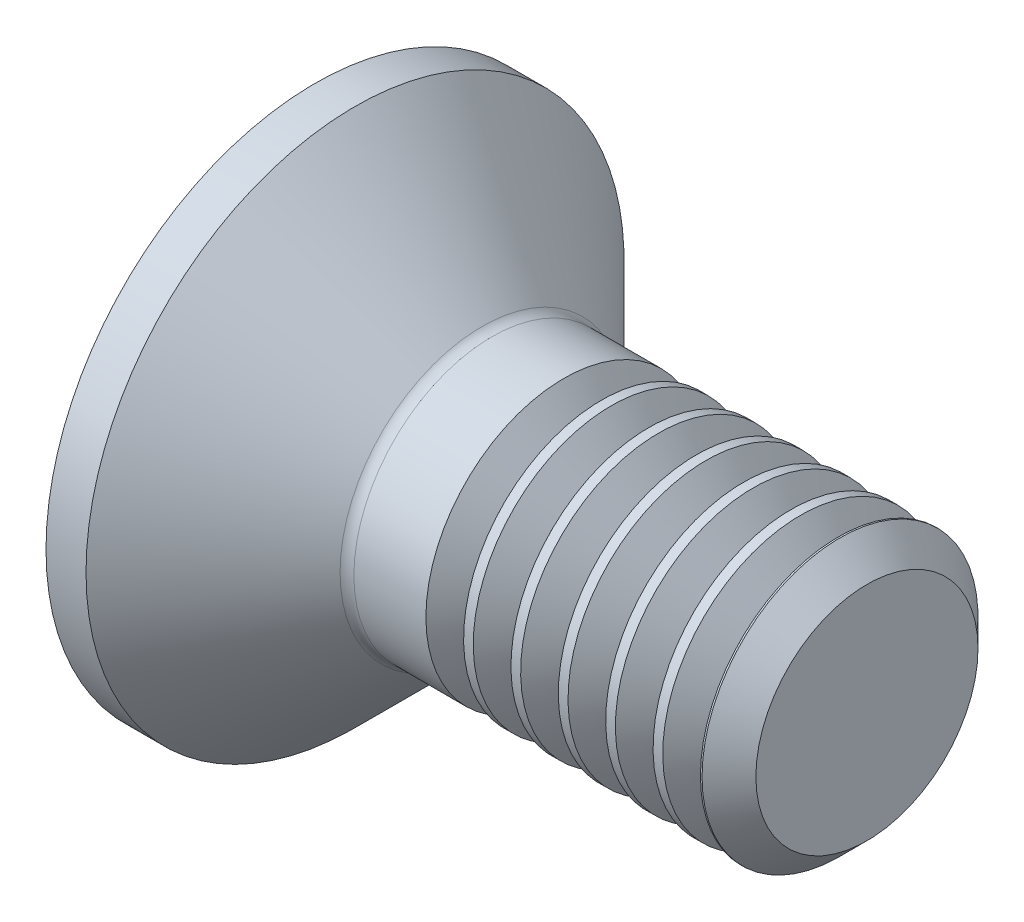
SolidWorks part; units mm, degrees
revolve "PreBroach" cut sketch "Sketch2"
sketch "Sketch2"
  line L0 (0, 1.25) -> (1.5, 1.25)
  line L1 (1.5, 1.25) -> (2.2217, 0)
  line L2 (0, 0) -> (127, 0) construction
  line L3 (2.2217, 0) -> (0, 0)
  line L4 (0, 0) -> (0, 1.25)
  line L5 (0, -1.25) -> (1.5, -1.25) construction
  line L6 (0, 0) -> (47.625, 0) construction
  line L8 (0, 3.9) -> (0, -3.9) construction
revolve "BaseBody" add sketch "BodySke" angle 360 about L6
sketch "BodySke" plane through (0, 0, 0) normal (0, 0, 1) x (1, 0, 0)
  line L0 (0, 0) -> (0, 3.9)
  line L1 (0.58, 3.9) -> (2.48, 2)
  line L2 (0, 3.9) -> (0.58, 3.9)
  line L3 (2.48, 2) -> (7.61, 2)
  line L4 (8, 1.61) -> (8, 0)
  line L5 (8, 0) -> (0, 0)
  line L6 (0, 0) -> (127, 0) construction
  line L7 (0.58, -3.9) -> (2.48, -2) construction
  line L8 (8, 1.61) -> (7.61, 2)
  line L9 (0, -3.9) -> (0.58, -3.9) construction
  line L10 (8, -1.61) -> (7.61, -2) construction
  line L11 (3.18, 8.35) -> (3.18, -13.875) construction
  line L12 (0, 19.05) -> (0, -3.175) construction
ref_plane "Plane1" through (0, 0, 0) normal (0, 0, 1) x (1, 0, 0)
ref_plane "Plane2" through (0, 0, 0) normal (0, 1, 0) x (1, 0, 0)
ref_plane "Plane3" through (0, 0, 0) normal (1, 0, 0) x (0, 0, -1)
fillet "Fillet1" radius 0.2 1 edges at (2.48, 0, 2)
sketch "Sketch3" plane through (0, 0, 0) normal (-1, 0, 0) x (0, 0, 1)
  line L0 (-1.25, -0.7217) -> (-1.25, 0.7217)
  line L1 (-1.25, 0.7217) -> (0, 1.4434)
  line L2 (0, 1.4434) -> (1.25, 0.7217)
  line L3 (1.25, 0.7217) -> (1.25, -0.7217)
  line L4 (1.25, -0.7217) -> (0, -1.4434)
  line L5 (0, -1.4434) -> (-1.25, -0.7217)
extrude "Hex" cut sketch "Sketch3" against normal blind 1.5
sketch "ThdSchSke" plane through (0, 0, 0) normal (0, 0, 1) x (1, 0, 0)
  line L0 (3.88, -1.61) -> (3.6069, -2)
  line L1 (3.88, -1.61) -> (4.1531, -2)
  line L2 (4.1531, -2) -> (4.1531, -2.5)
  line L3 (-3.175, 0) -> (5.1513, 0) construction
  line L4 (0, 3.9) -> (0, -3.9) construction
  line L5 (4.1531, -2.5) -> (3.6069, -2.5)
  line L6 (3.6069, -2.5) -> (3.6069, -2)
revolve "ThreadSchematic" cut sketch "ThdSchSke" angle 360 about L3
pattern_linear "ThdSchPat" count 6 spacing 0.6867 along (1, 0, 0) of "ThreadSchematic"
equation "\"Thread_minor@ThreadCosmetic\"  =  \"Minor_dia@BodySke\""
equation "\"D1@Sketch3\" = \"Hex_size@Sketch3\" / 2"
equation "\"D2@Sketch3\" = \"D1@Sketch3\""
equation "\"D3@Sketch3\" = \"Hex_size@Sketch3\""
equation "\"Thread_length@ThreadCosmetic\" = ((sgn( (\"Length@BodySke\" - \"Advance@BodySke\" * 2.0 - \"Head_ht@BodySke\" ) - \"Thread_nom@BodySke\" )-1)*( (\"Length@BodySke\" - \"Advance@BodySke\" * 2.0 - \"Head_ht@BodySke\" "
equation "\"Thread_minor@ThdSchSke\" = \"Minor_dia@BodySke\""
equation "\"Diameter@ThdSchSke\" = \"Diameter@BodySke\""
equation "\"Overcut@ThdSchSke\" = \"Diameter@BodySke\" * 1.25"
equation "\"Start@ThdSchSke\" = 0.000001 + \"Length@BodySke\" - \"Thread_length@ThreadCosmetic\"  '---Countersunk---"
equation "\"Num_threads@ThdSchPat\" = int( \"Thread_length@ThreadCosmetic\" / \"Advance@BodySke\" + 0.999 )  + 1"
equation "\"Advance@ThdSchPat\" = \"Thread_length@ThreadCosmetic\" /  (\"Num_threads@ThdSchPat\" - 1) 'relax it"
equation "\"Num_threads@ThdSchPat\" = \"Num_threads@ThdSchPat\" - sgn( \"Num_threads@ThdSchPat\" - 1) '---chamfered tips only---"
